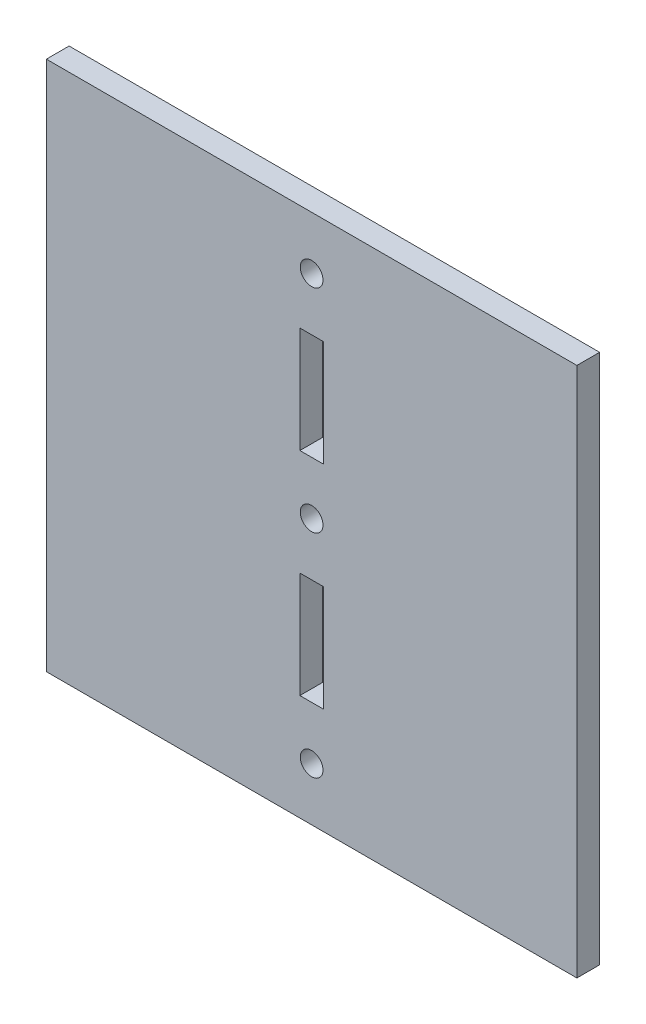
SolidWorks part; units mm, degrees
ref_plane "Front Plane" through (0, 0, 0) normal (0, 0, 1) x (1, 0, 0)
ref_plane "Top Plane" through (0, 0, 0) normal (0, 1, 0) x (1, 0, 0)
ref_plane "Right Plane" through (0, 0, 0) normal (1, 0, 0) x (0, 0, -1)
sketch "Sketch1" plane through (0, 0, 0) normal (0, 0, 1) x (1, 0, 0)
  line L0 (0, -1000) -> (0, 49000) construction
  line L1 (-35, -35) -> (35, -35)
  line L2 (-35, -35) -> (-35, 35)
  line L3 (-35, 35) -> (35, 35)
  line L4 (35, -35) -> (35, 35)
  line L5 (-35, -35) -> (35, 35) construction
  line L6 (-35, 35) -> (35, -35) construction
  line L8 (-1.55, 7) -> (1.55, 7)
  line L9 (-1.55, 7) -> (-1.55, 21)
  line L10 (-1.55, 21) -> (1.55, 21)
  line L11 (1.55, 7) -> (1.55, 21)
  line L12 (-1.55, 7) -> (1.55, 21) construction
  line L13 (-1.55, 21) -> (1.55, 7) construction
  line L14 (-1.55, -21) -> (1.55, -21)
  line L15 (-1.55, -21) -> (-1.55, -7)
  line L16 (-1.55, -7) -> (1.55, -7)
  line L17 (1.55, -21) -> (1.55, -7)
  line L18 (-1.55, -21) -> (1.55, -7) construction
  line L19 (-1.55, -7) -> (1.55, -21) construction
  circle A0 centre (0, 0) radius 1.5
  circle A1 centre (0, 28) radius 1.5
  circle A2 centre (0, -28) radius 1.5
  point P0 (0, 0)
  point P7 (0, 14)
  point P13 (0, -14)
  dimension "D8" = 3
  dimension "D10" = 7
  dimension "D1" = 70
  dimension "D2" = 70
  dimension "D3" = 14
  dimension "D4" = 14
  dimension "D5" = 3.1
  dimension "D6" = 3.1
  dimension "D7" = 14
  dimension "D9" = 7
  dimension "D11" = 7
extrude "Boss-Extrude1" add sketch "Sketch1" along normal blind 3
